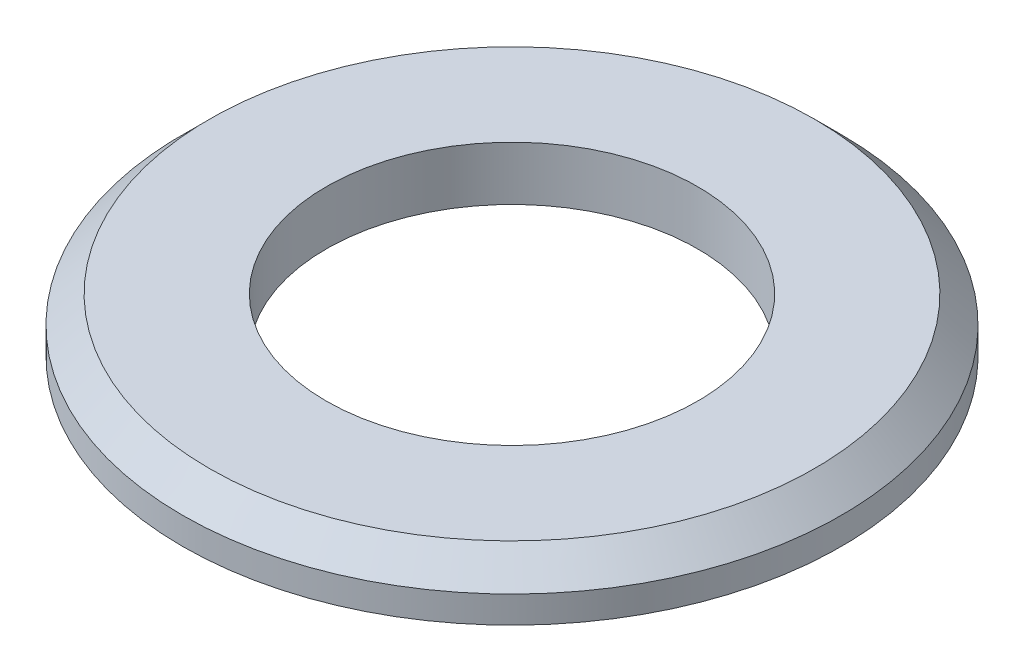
SolidWorks part; units mm, degrees
ref_plane "Front" through (0, 0, 0) normal (0, 0, 1) x (1, 0, 0)
ref_plane "Top" through (0, 0, 0) normal (0, 1, 0) x (1, 0, 0)
ref_plane "Right" through (0, 0, 0) normal (1, 0, 0) x (0, 0, -1)
sketch "Sketch1" plane through (0, 0, 0) normal (0, 1, 0) x (1, 0, 0)
  circle A0 centre (0, 0) radius 31
  circle A1 centre (0, 0) radius 55
extrude "Extrude1" add sketch "Sketch1" along normal blind 9
chamfer "Chamfer1" distance 4.5 1 edges at (0, 9, 55)
